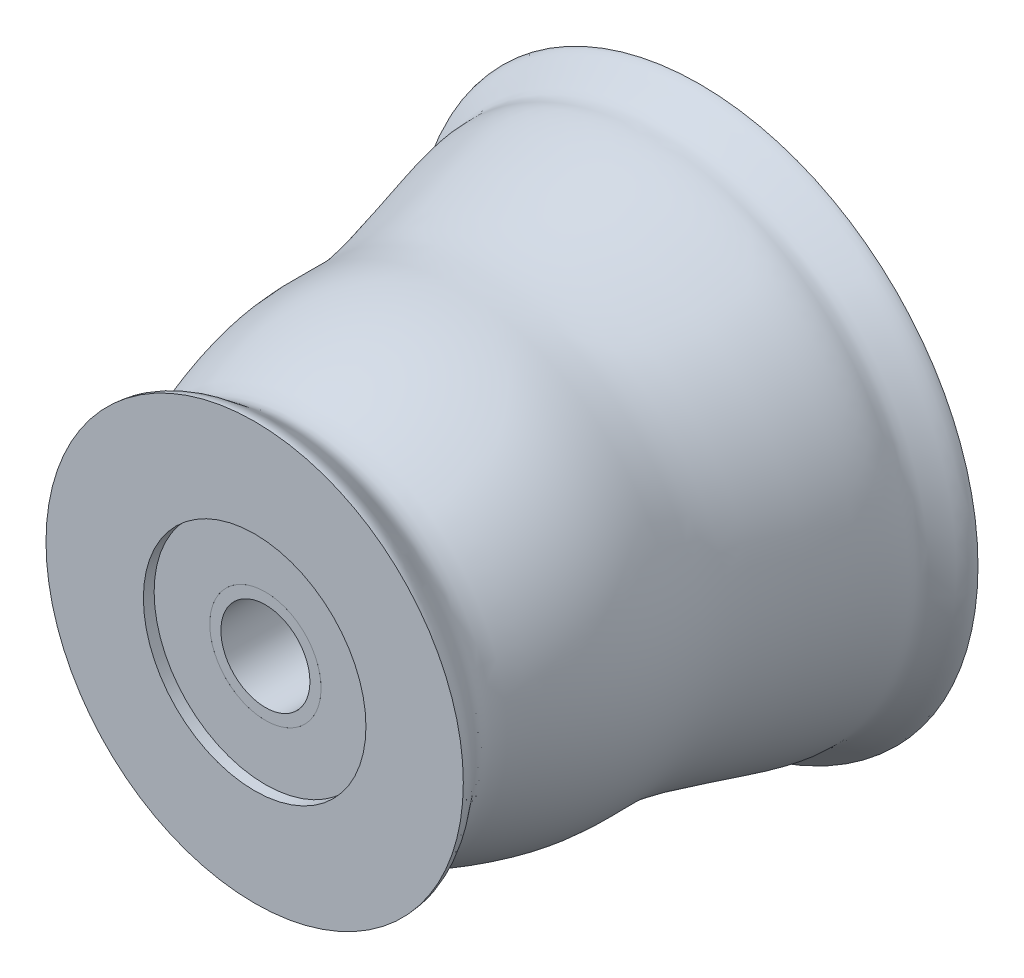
SolidWorks part; units mm, degrees
ref_plane "Front Plane" through (0, 0, 0) normal (0, 0, 1) x (1, 0, 0)
ref_plane "Top Plane" through (0, 0, 0) normal (0, 1, 0) x (1, 0, 0)
ref_plane "Right Plane" through (0, 0, 0) normal (1, 0, 0) x (0, 0, -1)
sketch "Sketch1" plane through (0, 0, 0) normal (1, 0, 0) x (0, 0, -1)
  line L0 (0, 0) -> (-7.2092, 0) construction
  line L1 (0, 0) -> (0, 2.5)
  line L2 (-4, 1.875) -> (-4, 1)
  line L3 (0, 1) -> (-0.2, 0.5)
  line L4 (-4, 1) -> (-3.9034, 1)
  line L5 (-0.2, 0.5) -> (-3.9034, 0.5)
  line L6 (-3.9034, 1) -> (-3.9034, 0.5)
  spline S0 degree 3 poles (-4, 1.875) (-3.8647, 1.875) (-3.7132, 1.6003) (-2.8232, 1.96) (-2.3897, 1.9936) (-1.6152, 1.959) (-0.5983, 2.3294) (-0.2536, 2.276) (-0.1093, 2.5) (0, 2.5) knots 0 0 0 0 0.06484 0.106378 0.381042 0.449703 0.724329 0.782792 1 1 1 1
  dimension "D1" = 4
  dimension "D2" = 0.4
  dimension "D3" = 0.4
  dimension "D4" = 2
  dimension "D5" = 0.2
  dimension "D6" = 0.2
  dimension "D7" = 0.1027
  dimension "D8" = 0.2
  dimension "D9" = 0.0966
  dimension "D10" = 5
  dimension "D11" = 3.75
  dimension "D12" = 1
  dimension "D13" = 2
  dimension "D14" = 2
revolve "Revolve1" add sketch "Sketch1" angle 360 about L0
sketch "Sketch2" plane through (0, 0, 3.9034) normal (0, 0, 1) x (1, 0, 0)
  circle A0 centre (0, 0) radius 0.5 construction
  circle A1 centre (0, 0) radius 0.5
  circle A2 centre (0, 0) radius 0.4
  dimension "D1" = 0.1
extrude "Boss-Extrude1" add sketch "Sketch2" against normal up to surface (3.7034 mm away) separate body
